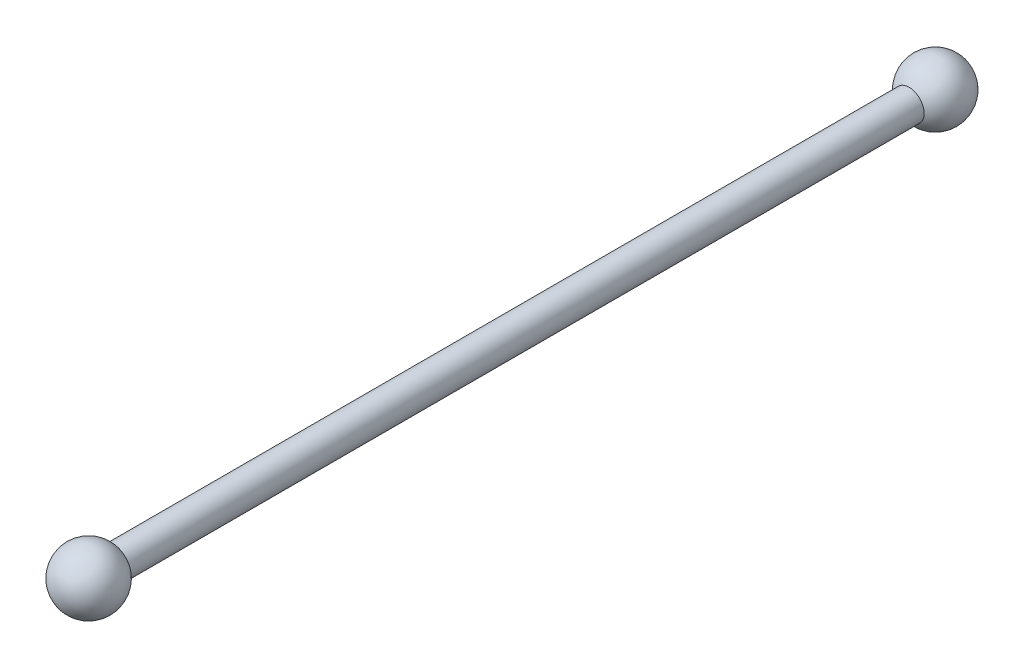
SolidWorks part; units mm, degrees
ref_plane "Front" through (0, 0, 0) normal (0, 0, 1) x (1, 0, 0)
ref_plane "Top" through (0, 0, 0) normal (0, 1, 0) x (1, 0, 0)
ref_plane "Right" through (0, 0, 0) normal (1, 0, 0) x (0, 0, -1)
sketch "Sketch2" plane through (0, 0, 0) normal (0, 0, 1) x (1, 0, 0)
  circle A0 centre (0, 0) radius 25
  dimension "D1" = 50
extrude "Boss-Extrude1" add sketch "Sketch2" along normal mid plane 1400
sketch "Sketch3" plane through (0, 0, 0) normal (0, 1, 0) x (1, 0, 0)
  line L0 (-25, -700) -> (25, -700) construction
  line L1 (0, -650) -> (0, -750)
  arc A0 (0, -750) -> (0, -650) centre (0, -700) ccw
  dimension "D1" = 50
revolve "Revolve1" add sketch "Sketch3" angle 360 about L1
mirror "Mirror1" about plane through (0, 0, 0) normal (0, 0, 1) of "Revolve1"
